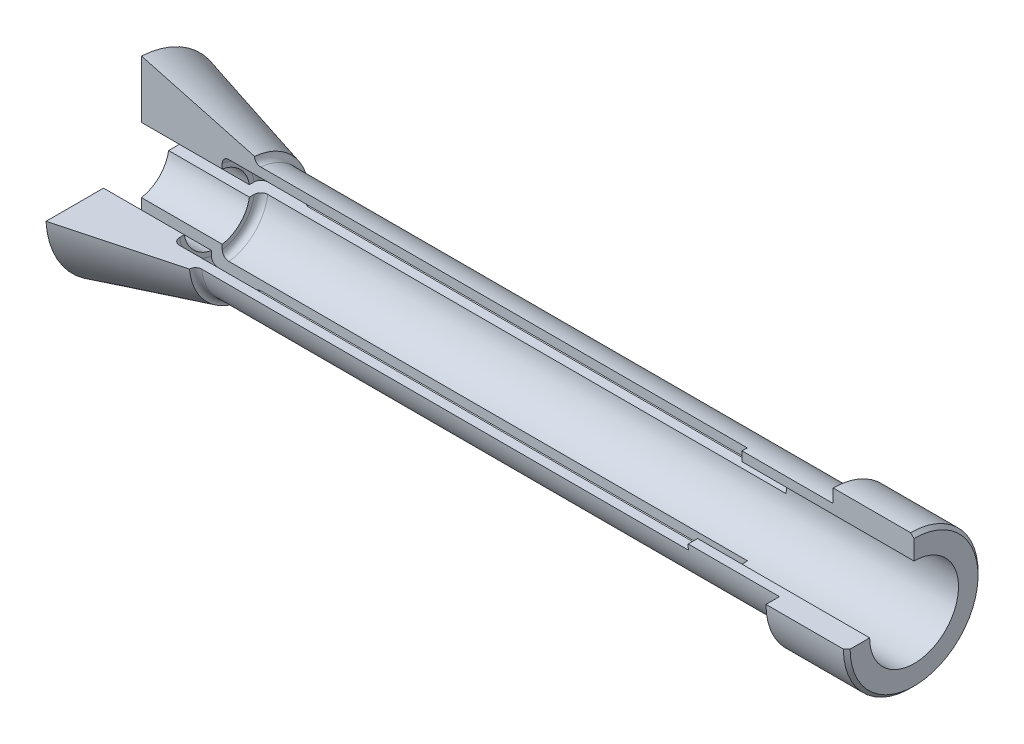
SolidWorks part; units mm, degrees
ref_plane "Face" through (0, 0, 0) normal (0, 0, 1) x (1, 0, 0)
ref_plane "Dessus" through (0, 0, 0) normal (0, 1, 0) x (1, 0, 0)
ref_plane "Droite" through (0, 0, 0) normal (1, 0, 0) x (0, 0, -1)
sketch "Esquisse1" plane through (0, 0, 0) normal (0, 0, 1) x (1, 0, 0)
  line L0 (-14.0874, 0) -> (93.1333, 0) construction
  line L1 (-3, 2.45) -> (-3, 6.7)
  line L2 (-3, 6.7) -> (5.4, 4.4492)
  line L3 (48.78, 5) -> (54.78, 5)
  line L5 (54.78, 5) -> (54.78, 3.3)
  line L6 (54.78, 3.3) -> (3.5, 3.3)
  line L7 (3, 2.8) -> (3, 2.45)
  line L8 (3, 2.45) -> (-3, 2.45)
  line L9 (0, 18.1647) -> (0, -8.6153) construction
  line L10 (48.78, 5) -> (48.78, 4)
  line L11 (5.8492, 4) -> (48.78, 4)
  arc A0 (5.4, 4.4492) -> (5.8492, 4) centre (5.8492, 4.4492) ccw
  arc A1 (3, 2.8) -> (3.5, 3.3) centre (3.5, 2.8) cw
  dimension "D10" = 0.5
  dimension "D1" = 6
  dimension "D2" = 13.4
  dimension "D3" = 6.6
  dimension "D4" = 8
  dimension "D5" = 8.4
  dimension "D6" = 15
  dimension "D7" = 4.9
  dimension "D8" = 57.78
  dimension "D11" = 10
  dimension "D12" = 6
revolve "Base-Révolution" add sketch "Esquisse1" angle 360 about L0
chamfer "Chanfrein1" distance 0.25 angle 45 1 edges at (54.78, 0, 5)
sketch "Esquisse2" plane through (-3, 0, 0) normal (-1, 0, 0) x (0, 0, 1)
  line L0 (0, 7.132) -> (0, -7.5183) construction
  line L1 (-8.0287, 0) -> (7.4769, 0) construction
  line L2 (-0.4, 6.688) -> (-0.4, 2.4171)
  line L3 (0.4, 6.688) -> (0.4, 2.4171)
  line L4 (-6.688, 0.4) -> (-2.4171, 0.4)
  line L5 (-6.688, -0.4) -> (-2.4171, -0.4)
  line L6 (-0.4, -2.4171) -> (-0.4, -6.688)
  line L8 (2.4171, 0.4) -> (6.688, 0.4)
  line L9 (2.4171, -0.4) -> (6.688, -0.4)
  line L10 (0.4, -2.4171) -> (0.4, -6.688)
  circle A0 centre (0, 0) radius 6.7 construction
  arc A1 (0.4, 6.688) -> (-0.4, 6.688) centre (0, 0) ccw
  circle A2 centre (0, 0) radius 2.45 construction
  arc A3 (-2.4171, 0.4) -> (-2.4171, -0.4) centre (0, 0) ccw
  arc A4 (-6.688, 0.4) -> (-6.688, -0.4) centre (0, 0) ccw
  arc A5 (-0.4, -6.688) -> (0.4, -6.688) centre (0, 0) ccw
  arc A6 (6.688, -0.4) -> (6.688, 0.4) centre (0, 0) ccw
  arc A7 (2.4171, -0.4) -> (2.4171, 0.4) centre (0, 0) ccw
  arc A8 (0.4, 2.4171) -> (-0.4, 2.4171) centre (0, 0) ccw
  arc A9 (-0.4, -2.4171) -> (0.4, -2.4171) centre (0, 0) ccw
  dimension "D1" = 0.8
  dimension "D2" = 0.8
extrude "Enlèv. mat.-Extru.1" cut sketch "Esquisse2" against normal blind 45
sketch "Esquisse3" plane through (-3, 0, 0) normal (-1, 0, 0) x (0, 0, 1)
  line L0 (0, 0) -> (0.0117, 6.7)
  line L1 (0, 0) -> (6.7, 0.0117)
  line L2 (0, 0) -> (8.445, 0) construction
  line L3 (0, 0) -> (0, 7.7306) construction
  arc A0 (6.688, 0.4) -> (0.4, 6.688) centre (0, 0) ccw construction
  arc A1 (6.7, 0.0117) -> (0.0117, 6.7) centre (0, 0) ccw
  dimension "D1" = 0.1
  dimension "D2" = 0.1
extrude "COUPE" cut sketch "Esquisse3" against normal through all
sketch "DIAMETRE VIS" plane through (0, 0, 0) normal (1, 0, 0) x (0, 0, -1)
  circle A0 centre (0, 0) radius 3
  dimension "D1" = 6
